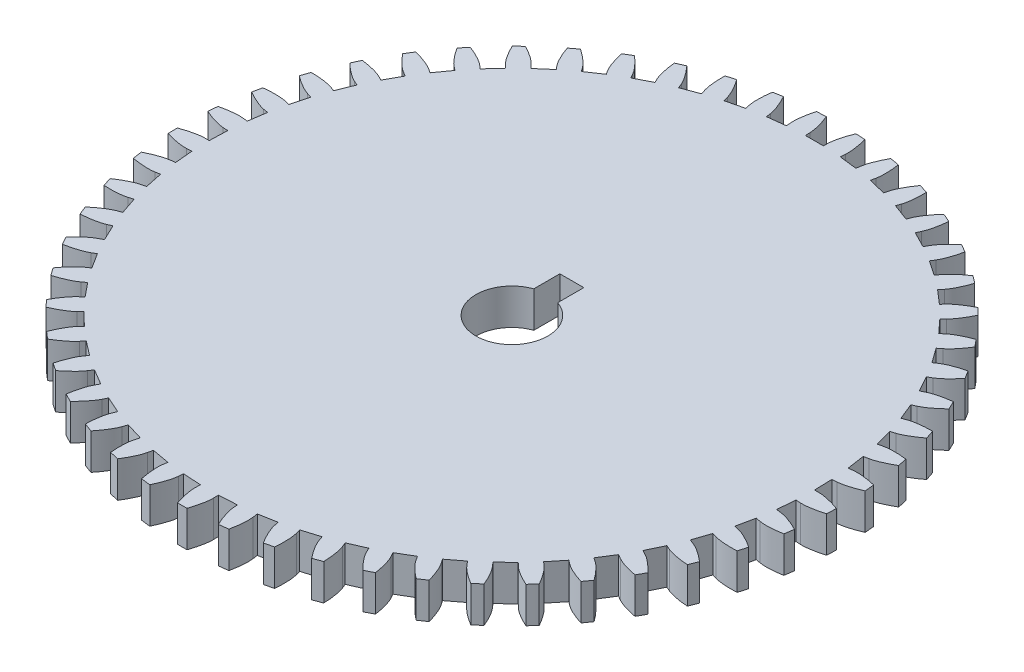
SolidWorks part; units mm, degrees
ref_plane "Front Plane" through (0, 0, 0) normal (0, 0, 1) x (1, 0, 0)
ref_plane "Top Plane" through (0, 0, 0) normal (0, 1, 0) x (1, 0, 0)
ref_plane "Right Plane" through (0, 0, 0) normal (1, 0, 0) x (0, 0, -1)
sketch "Sketch1" plane through (0, 0, 0) normal (0, 1, 0) x (1, 0, 0)
  line L0 (0, 0) -> (0, 12.828) construction
  line L1 (0, 0) -> (-12.828, 0) construction
  line L2 (0, 0) -> (-13.744, -0.4075) construction
  line L3 (0, 0) -> (-12.8054, -0.7599) construction
  line L4 (0, 0) -> (-12.7379, -1.5172) construction
  circle A0 centre (0, 0) radius 13.25 construction
  circle A1 centre (0, 0) radius 12.828 construction
  circle A2 centre (0, 0) radius 12.625 construction
  circle A3 centre (0, 0) radius 13.75 construction
  spline S0 degree 4 poles (-12.828, 0) (-12.8509, 0) (-12.9153, -0.0024) (-13.0365, -0.0162) (-13.2324, -0.0518) (-13.4784, -0.1163) (-13.7903, -0.2213) (-14.1486, -0.372) (-14.5308, -0.5655) (-14.9322, -0.8047) (-15.3184, -1.0684) (-15.6892, -1.3534) (-16.0447, -1.6571) (-16.4577, -2.0462) (-16.9276, -2.5439) (-17.4366, -3.1633) (-17.9644, -3.915) (-18.4455, -4.7176) (-18.8711, -5.5504) (-19.1964, -6.3019) (-19.4422, -6.9581) (-19.6256, -7.514) (-19.7595, -7.9599) (-19.9114, -8.5281) (-20.0421, -9.0907) (-20.1532, -9.6751) (-20.2617, -10.3517) (-20.334, -10.961) (-20.3843, -11.4923) (-20.4249, -12.2405) (-20.4349, -12.6255) (-20.4399, -13.2254) (-20.4291, -13.4989) (-20.4244, -13.7414) (-20.4198, -13.814) (-20.4179, -13.8664) (-20.417, -13.8947) knots 0 0 0 0 0 0.005377 0.015084 0.028532 0.04661 0.064855 0.092111 0.119476 0.146842 0.174209 0.201575 0.228941 0.256307 0.307035 0.361767 0.4165 0.471232 0.525964 0.580697 0.608063 0.635429 0.662795 0.690161 0.744894 0.77226 0.799626 0.854358 0.881725 0.909091 0.954545 0.977273 0.988636 0.994318 1 1 1 1 1 construction
  spline S1 degree 4 poles (-12.828, 0) (-12.8509, 0) (-12.9153, -0.0024) (-13.0365, -0.0162) (-13.2324, -0.0518) (-13.4784, -0.1163) (-13.7903, -0.2213) (-14.1486, -0.372) (-14.5308, -0.5655) (-14.9322, -0.8047) (-15.3184, -1.0684) (-15.6892, -1.3534) (-16.0447, -1.6571) (-16.4577, -2.0462) (-16.9276, -2.5439) (-17.4366, -3.1633) (-17.9644, -3.915) (-18.4455, -4.7176) (-18.8711, -5.5504) (-19.1964, -6.3019) (-19.4422, -6.9581) (-19.6256, -7.514) (-19.7595, -7.9599) (-19.9114, -8.5281) (-20.0421, -9.0907) (-20.1532, -9.6751) (-20.2617, -10.3517) (-20.334, -10.961) (-20.3843, -11.4923) (-20.413, -12.021) (-20.4219, -12.2346) (-20.4254, -12.3407) knots 0 0 0 0 0 0.005377 0.015084 0.028532 0.04661 0.064855 0.092111 0.119476 0.146842 0.174209 0.201575 0.228941 0.256307 0.307035 0.361767 0.4165 0.471232 0.525964 0.580697 0.608063 0.635429 0.662795 0.690161 0.744894 0.77226 0.799626 0.854358 0.881725 0.909091 0.909091 0.909091 0.909091 0.909091
  dimension "D1" = 27.5
  dimension "D2" = 26.5
  dimension "D3" = 25.6559
  dimension "D4" = 25.25
  dimension "D5" = 12.828
  dimension "D6" = 1.698
  dimension "D7" = 3.396
  dimension "D8" = 6.792
sketch "Sketch2" plane through (0, 0, 0) normal (0, 1, 0) x (1, 0, 0)
  line L0 (0, 0) -> (-13.744, -0.4075) construction
  line L1 (0, 0) -> (-13.744, -0.4075) construction
  line L2 (0, 0) -> (-12.8054, -0.7599) construction
  line L3 (0, 0) -> (-12.828, 0) construction
  line L4 (0, 0) -> (-12.7379, -1.5172) construction
  line L5 (0, 0) -> (-12.8054, -0.7599) construction
  line L6 (0, 0) -> (-12.828, 0) construction
  line L7 (0, 0) -> (-12.7379, -1.5172) construction
  line L8 (-12.8054, -0.7599) -> (-12.6028, -0.7479)
  line L9 (-12.6028, -0.7479) -> (-12.5364, -1.4932)
  line L10 (-12.5364, -1.4932) -> (-12.7379, -1.5172) construction
  line L11 (-12.5364, -1.4932) -> (-1.4895, -0.1774)
  line L12 (-12.828, 0) -> (-1.5, 0)
  circle A0 centre (0, 0) radius 12.625 construction
  circle A1 centre (0, 0) radius 12.828 construction
  circle A2 centre (0, 0) radius 13.25 construction
  circle A3 centre (0, 0) radius 13.75 construction
  circle A4 centre (0, 0) radius 12.625 construction
  circle A5 centre (0, 0) radius 12.828 construction
  circle A6 centre (0, 0) radius 13.25 construction
  circle A7 centre (0, 0) radius 13.75 construction
  arc A8 (-13.7367, -0.6035) -> (-13.7484, -0.2113) centre (0, 0) cw
  circle A11 centre (0, 0) radius 1.5 construction
  arc A12 (-1.5, 0) -> (-1.4895, -0.1774) centre (0, 0) ccw
  spline S0 degree 4 poles (-40.5141, -999.547) (-9.4466, -24.4403) (-10.3116, -0.5547) (-11.8153, 0.2061) (-13.2324, -0.0518) (-13.4784, -0.1163) (-13.7903, -0.2213) (-14.1486, -0.372) (-14.5308, -0.5655) (-14.9322, -0.8047) (-15.3184, -1.0684) (-15.6892, -1.3534) (-16.0447, -1.6571) (-16.4577, -2.0462) (-16.9276, -2.5439) (-17.4366, -3.1633) (-17.9644, -3.915) (-18.4455, -4.7176) (-18.8711, -5.5504) (-19.1964, -6.3019) (-19.4422, -6.9581) (-19.6256, -7.514) (-19.7595, -7.9599) (-19.9114, -8.5281) (-20.0421, -9.0907) (-20.1532, -9.6751) (-20.2617, -10.3517) (-20.334, -10.961) (-20.5265, -12.9916) (-20.4703, -17.0406) (-18.931, 17.7495) (-52.5659, -1011.7479) knots -0.290545 -0.290545 -0.290545 -0.290545 -0.290545 0.005377 0.015084 0.028532 0.04661 0.064855 0.092111 0.119476 0.146842 0.174209 0.201575 0.228941 0.256307 0.307035 0.361767 0.4165 0.471232 0.525964 0.580697 0.608063 0.635429 0.662795 0.690161 0.744894 0.77226 0.799626 0.854358 0.881725 1.295228 1.295228 1.295228 1.295228 1.295228 only from (-12.828, 0) to (-20.4254, -12.3407) construction
  spline S1 degree 4 poles (-12.828, 0) (-12.8509, 0) (-12.9153, -0.0024) (-13.0365, -0.0162) (-13.2324, -0.0518) (-13.4398, -0.1062) (-13.6042, -0.1592) (-13.7127, -0.1981) (-13.7484, -0.2113) knots 0 0 0 0 0 0.005377 0.015084 0.028532 0.04661 0.055523 0.055523 0.055523 0.055523 0.055523
  spline S2 degree 4 poles (-12.8054, -0.7599) (-12.8284, -0.7613) (-12.8928, -0.7627) (-13.0146, -0.7562) (-13.2123, -0.7322) (-13.4225, -0.6902) (-13.5897, -0.647) (-13.7003, -0.6146) (-13.7367, -0.6035) knots 0 0 0 0 0 0.005377 0.015084 0.028532 0.04661 0.055523 0.055523 0.055523 0.055523 0.055523
  point P21 (-12.6028, -0.7479)
  point P24 (-12.5364, -1.4932)
  dimension "D2" = 3
extrude "Boss-Extrude1" add sketch "Sketch2" along normal blind 1.5
pattern_circular "CirPattern1" count 53 over 360 of "Boss-Extrude1"
sketch "Sketch3" plane through (0, 1.5, 0) normal (0, 1, 0) x (1, 0, 0)
  line L1 (0.5, 0.5) -> (-0.5, 0.5)
  line L2 (0.5, 0.5) -> (0.5, 2.5)
  line L3 (0.5, 2.5) -> (-0.5, 2.5)
  line L4 (-0.5, 0.5) -> (-0.5, 2.5)
  line L5 (0.5, 0.5) -> (-0.5, 2.5) construction
  line L6 (0.5, 2.5) -> (-0.5, 0.5) construction
  circle A0 centre (0, 0) radius 1.5 construction
  point P0 (0, 1.5)
  dimension "D1" = 2
  dimension "D2" = 1
extrude "Cut-Extrude1" cut sketch "Sketch3" against normal up to surface (1.5 mm away)
equation "\"Module\"= .5"
equation "\"Number of Teeth\"= 53"
equation "\"Pressure Angle\"= 14.5deg"
equation "\"Pitch Diameter\"= \"Number of Teeth\" * \"Module\""
equation "\"Circular Pitch\"= pi * \"Module\""
equation "\"Addendum\"= \"Module\""
equation "\"Dedendum\"= 1.25 * \"Module\""
equation "\"Base Diameter\"= \"Pitch Diameter\" * cos ( \"Pressure Angle\" )"
equation "\"Base Radius\"= \"Base Diameter\" / 2"
equation "\"Width\"= 1.5"
equation "\"Outside Diameter\"= \"Pitch Diameter\" + 2 * \"Addendum\""
equation "\"D1@Sketch1\"=\"Outside Diameter\""
equation "\"D3@Sketch1\"=\"Base Diameter\""
equation "\"Root Diameter\"= \"Pitch Diameter\" - 2 * \"Dedendum\""
equation "\"D4@Sketch1\"=\"Root Diameter\""
equation "\"Tooth Angle\"= 360 / \"Number of Teeth\""
equation "\"D6@Sketch1\"=\"Tooth Angle\"/4"
equation "\"D7@Sketch1\"=\"Tooth Angle\"/2"
equation "\"D8@Sketch1\"=\"Tooth Angle\""
equation "\"D2@Sketch1\" = \"Pitch Diameter\""
equation "\"Shaft Diameter\"= 3"
equation "\"D1@CirPattern1\" = \"Number of Teeth\""
equation "\"D2@Sketch2\"= \"Shaft Diameter\""
equation "\"D1@Boss-Extrude1\" = \"Width\""
